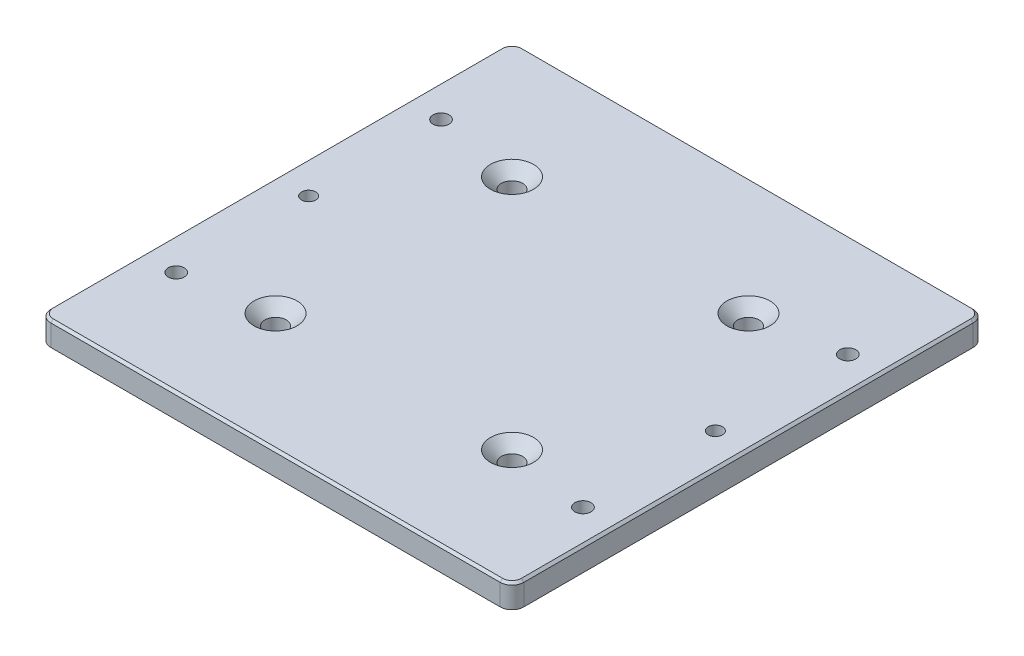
SolidWorks part; units mm, degrees
ref_plane "Ebene vorne" through (0, 0, 0) normal (0, 0, 1) x (1, 0, 0)
ref_plane "Ebene oben" through (0, 0, 0) normal (0, 1, 0) x (1, 0, 0)
ref_plane "Ebene rechts" through (0, 0, 0) normal (1, 0, 0) x (0, 0, -1)
sketch "Skizze1" plane through (0, 0, 0) normal (0, 1, 0) x (1, 0, 0)
  line L5 (-100, -100) -> (100, -100)
  line L6 (-100, -100) -> (-100, 100)
  line L7 (-100, 100) -> (100, 100)
  line L8 (100, -100) -> (100, 100)
  line L9 (-100, -100) -> (100, 100) construction
  line L10 (-100, 100) -> (100, -100) construction
  point P0 (0, 0)
  dimension "D1" = 200
  dimension "D2" = 200
extrude "Aufsatz-Linear austragen1" add sketch "Skizze1" against normal blind 10
hole_wizard "M8 Gewindebohrung1" positions "Skizze9" profile "Skizze10" tap size "M8" standard "ISO"
sketch "Skizze9" plane through (0, 0, 0) normal (0, 1, 0) x (1, 0, 0)
  line L16 (-86, 56) -> (86, 56) construction
  line L17 (-86, 56) -> (-86, -56) construction
  line L18 (-86, -56) -> (86, -56) construction
  line L19 (86, 56) -> (86, -56) construction
  line L20 (-86, 56) -> (86, -56) construction
  line L21 (-86, -56) -> (86, 56) construction
  point P1 (-86, -56)
  point P2 (86, 56)
  point P223 (-86, 56)
  point P224 (86, -56)
  dimension "D1" = 112
  dimension "D2" = 172
sketch "Skizze10" plane through (-86, 0, 56) normal (1, 0, 0) x (0, 0, 1)
  line L0 (0, 0) -> (0, 10)
  line L1 (0, 10) -> (3.4, 10)
  line L2 (3.4, 10) -> (3.4, 0)
  line L5 (3.4, 0) -> (0, 0)
  line L11 (0, -6.35) -> (0, 107.95) construction
  dimension "Bohrerdurchmesser" = 6.8
  dimension "Bohrungstiefe" = 10
hole_wizard "Formsenkung für M8 Senkschraube mit Innensechskant1" positions "Skizze11" profile "Skizze12" countersink size "M8" standard "DIN"
sketch "Skizze11" plane through (0, 0, 0) normal (0, 1, 0) x (1, 0, 0)
  line L1 (-50, -50) -> (50, -50) construction
  line L2 (-50, -50) -> (-50, 50) construction
  line L3 (-50, 50) -> (50, 50) construction
  line L4 (50, -50) -> (50, 50) construction
  line L9 (0, 50) -> (0, -50) construction
  line L11 (-50, 0) -> (50, 0) construction
  point P1 (-50, -50)
  point P2 (50, 50)
  point P317 (-50, 50)
  point P318 (50, -50)
  dimension "D1" = 100
  dimension "D2" = 100
sketch "Skizze12" plane through (-50, 0, 50) normal (1, 0, 0) x (0, 0, 1)
  line L0 (0, 0) -> (0, 10)
  line L1 (0, 10) -> (4.5, 10)
  line L2 (4.5, 10) -> (4.5, 4.625)
  line L3 (4.5, 4.625) -> (9.125, 0)
  line L5 (9.125, 0) -> (0, 0)
  line L6 (-4.5, 4.625) -> (-9.125, 0) construction
  line L11 (0, -6.35) -> (0, 107.95) construction
  dimension "Bohrerdurchmesser" = 9
  dimension "Bohrungstiefe" = 10
  dimension "Senkdurchmesser (Oben)" = 18.25
  dimension "Senkwinkel (Oben)" = 90
hole_wizard "Ø6.0mm Stiftloch1" positions "Skizze13" profile "Skizze14" hole size "Ø6.0" standard "DIN"
sketch "Skizze13" plane through (0, 0, 0) normal (0, 1, 0) x (1, 0, 0)
  line L2 (-86, 56) -> (-86, -56) construction
  line L3 (86, 56) -> (86, -56) construction
  point P0 (86, 0)
  point P4 (-86, 0)
sketch "Skizze14" plane through (86, 0, 0) normal (1, 0, 0) x (0, 0, 1)
  line L0 (0, 0) -> (0, 10)
  line L1 (0, 10) -> (3, 10)
  line L2 (3, 10) -> (3, 0)
  line L5 (3, 0) -> (0, 0)
  line L11 (0, -6.35) -> (0, 107.95) construction
  dimension "Bohrerdurchmesser" = 6
  dimension "Bohrungstiefe" = 10
fillet "Verrundung1" radius 5 4 edges at (100, -5, -100) (-100, -5, -100) (-100, -5, 100) (100, -5, 100)
chamfer "Fase1" distance 1 angle 45 8 edges at (0, 0, 100) (98.5355, 0, 98.5355) (-98.5355, 0, 98.5355) (100, 0, 0) (-100, 0, 0) (98.5355, 0, -98.5355) (-98.5355, 0, -98.5355) (0, 0, -100)
